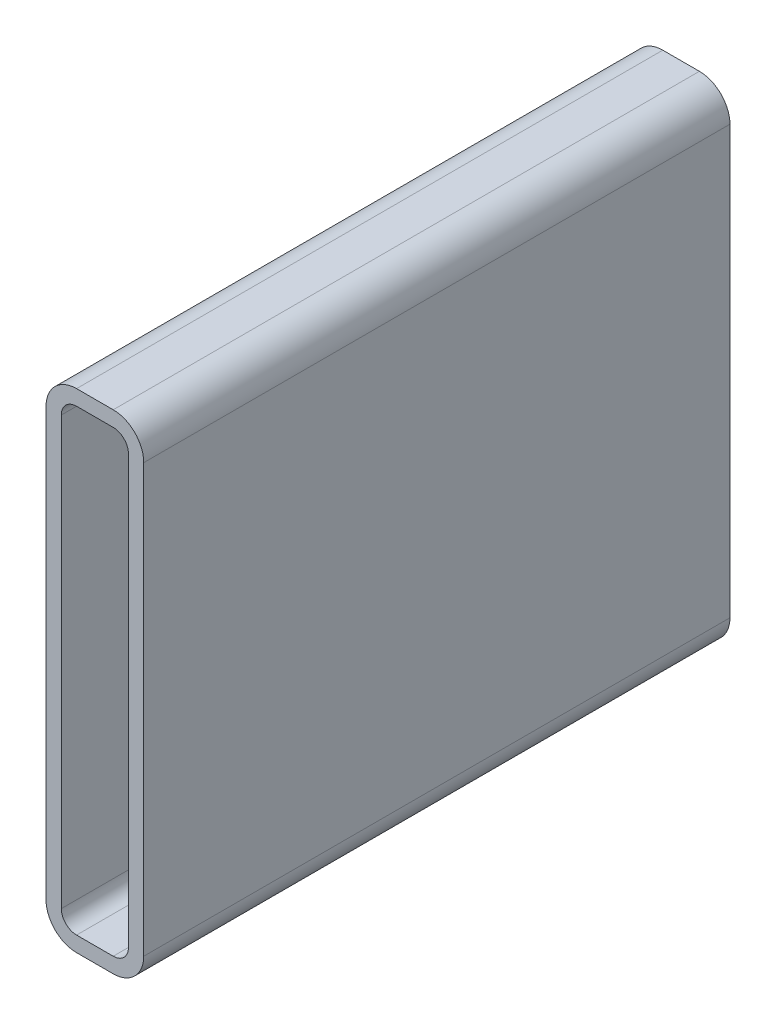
SolidWorks part; units mm, degrees
ref_plane "Front Plane" through (0, 0, 0) normal (0, 0, 1) x (1, 0, 0)
ref_plane "Top Plane" through (0, 0, 0) normal (0, 1, 0) x (1, 0, 0)
ref_plane "Right Plane" through (0, 0, 0) normal (1, 0, 0) x (0, 0, -1)
sketch "Sketch1" plane through (0, 0, 0) normal (0, 0, 1) x (1, 0, 0)
  line B0 (15.875, 254) -> (34.925, 254)
  arc B1 (50.8, 238.125) -> (34.925, 254) centre (34.925, 238.125) ccw
  line B2 (50.8, 238.125) -> (50.8, 15.875)
  arc B3 (34.925, 0) -> (50.8, 15.875) centre (34.925, 15.875) ccw
  line B4 (34.925, 0) -> (15.875, 0)
  arc B5 (0, 15.875) -> (15.875, 0) centre (15.875, 15.875) ccw
  line B6 (0, 15.875) -> (0, 238.125)
  arc B7 (15.875, 254) -> (0, 238.125) centre (15.875, 238.125) ccw
  line B8 (15.875, 246.0625) -> (34.925, 246.0625)
  arc B9 (42.8625, 238.125) -> (34.925, 246.0625) centre (34.925, 238.125) ccw
  line B10 (42.8625, 238.125) -> (42.8625, 15.875)
  arc B11 (34.925, 7.9375) -> (42.8625, 15.875) centre (34.925, 15.875) ccw
  line B12 (34.925, 7.9375) -> (15.875, 7.9375)
  arc B13 (7.9375, 15.875) -> (15.875, 7.9375) centre (15.875, 15.875) ccw
  line B14 (7.9375, 15.875) -> (7.9375, 238.125)
  arc B15 (15.875, 246.0625) -> (7.9375, 238.125) centre (15.875, 238.125) ccw
sketch_block_instance "HSS10x2x0.3125-1"
sketch_block "HSS10x2x0.3125"
extrude "Boss-Extrude1" add sketch "Sketch1" along normal blind 304.8
